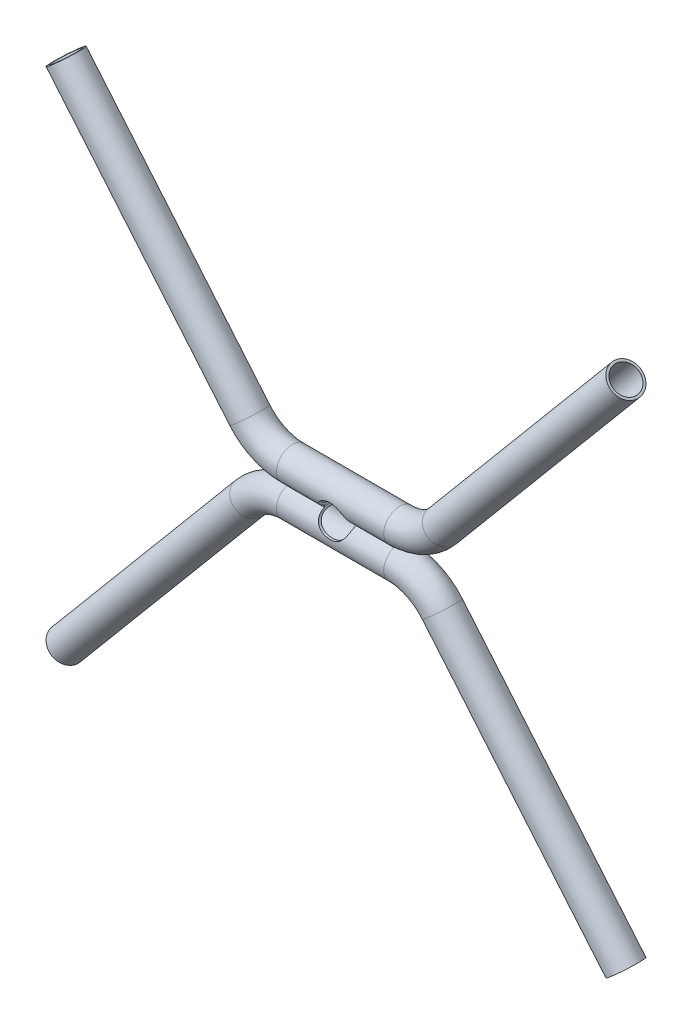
SolidWorks part; units mm, degrees
other "Detailelement1"
ref_plane "Ebene vorne" through (0, 0, 0) normal (0, 0, 1) x (1, 0, 0)
ref_plane "Ebene oben" through (0, 0, 0) normal (0, 1, 0) x (1, 0, 0)
ref_plane "Ebene rechts" through (0, 0, 0) normal (1, 0, 0) x (0, 0, -1)
sketch "Skizze1" plane through (0, 0, 0) normal (0, 0, 1) x (1, 0, 0)
  line L1 (0, 0) -> (-33.6792, 0)
  line L2 (-60.4908, -12.5024) -> (-175.8649, -150)
  line L3 (0, 34.0258) -> (0, -80.3148) construction
  arc A0 (-33.6792, 0) -> (-60.4908, -12.5024) centre (-33.6792, -35) ccw
  point P10 (-50, 0)
  point P13 (50, 0)
  dimension "D6" = 35
  dimension "D1" = 50
  dimension "D2" = 50
  dimension "D4" = 150
sketch "Skizze2" plane through (0, 0, 0) normal (1, 0, 0) x (0, 0, -1)
  circle A0 centre (0, 0) radius 10
  circle A1 centre (0, 0) radius 8.5
  dimension "D1" = 20
  dimension "D2" = 1.5
sweep "Austragung3" add profiles "Skizze2" path "Skizze1"
mirror "Spiegeln2" about plane through (0, 0, 0) normal (1, 0, 0) of "Austragung3"
ref_plane "Ebene1" through (0, 10, 0) normal (0, 1, 0) x (-1, 0, 0)
mirror "Spiegeln6" about plane through (0, 10, 0) normal (0, 1, 0)
other "Kehlnaht1" parameters "D10"=6, "D11"=50, "D12"=0, "D13"=3, "D14"=0
sketch "Skizze3" plane through (0, 0, 0) normal (0, 0, 1) x (1, 0, 0)
  line L0 (159.9965, 10) -> (-159.9965, 10) construction
  circle A0 centre (0, 10) radius 10
  dimension "D1" = 20
extrude "Linear austragen2" cut sketch "Skizze3" against normal through all and the other way through all
